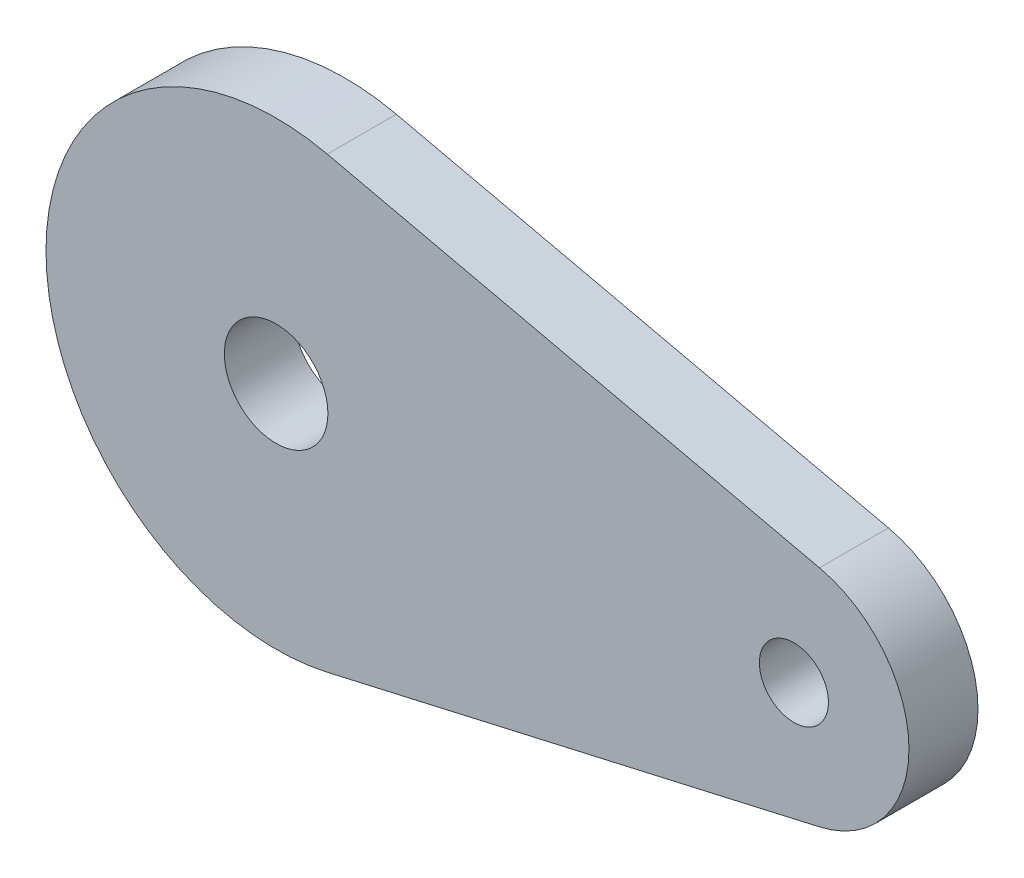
SolidWorks part; units mm, degrees
ref_plane "前视基准面" through (0, 0, 0) normal (0, 0, 1) x (1, 0, 0)
ref_plane "上视基准面" through (0, 0, 0) normal (0, 1, 0) x (1, 0, 0)
ref_plane "右视基准面" through (0, 0, 0) normal (1, 0, 0) x (0, 0, -1)
sketch "草图1" plane through (0, 0, 0) normal (0, 0, 1) x (1, 0, 0)
  line L0 (0, 0) -> (90, 0) construction
  line L1 (8.8889, 38.9998) -> (94.4444, 19.4999)
  line L2 (8.8889, -38.9998) -> (94.4444, -19.4999)
  arc A0 (8.8889, 38.9998) -> (8.8889, -38.9998) centre (0, 0) ccw
  circle A1 centre (0, 0) radius 9
  arc A2 (94.4444, -19.4999) -> (94.4444, 19.4999) centre (90, 0) ccw
  circle A3 centre (90, 0) radius 6
extrude "凸台-拉伸1" add sketch "草图1" along normal blind 12
